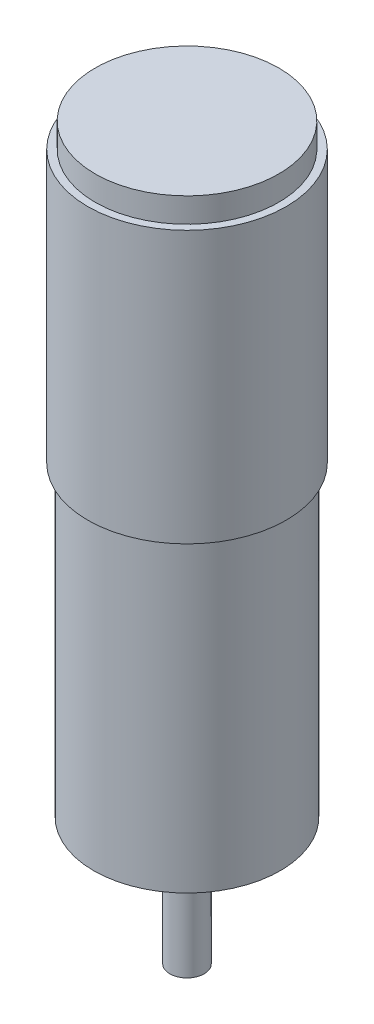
SolidWorks part; units mm, degrees
ref_plane "Front" through (0, 0, 0) normal (0, 0, 1) x (1, 0, 0)
ref_plane "Top" through (0, 0, 0) normal (0, 1, 0) x (1, 0, 0)
ref_plane "Right" through (0, 0, 0) normal (1, 0, 0) x (0, 0, -1)
sketch "Sketch1" plane through (0, 0, 0) normal (0, 1, 0) x (1, 0, 0)
  circle A0 centre (0, 0) radius 8.001
  dimension "D1" = 16.002
extrude "Base-Extrude" add sketch "Sketch1" along normal blind 26.289
sketch "Sketch2" plane through (0, 26.289, 0) normal (0, 1, 0) x (-1, 0, 0)
  circle A0 centre (0, 0) radius 8.509
  dimension "D1" = 17.018
extrude "Boss-Extrude1" add sketch "Sketch2" along normal blind 25.4
sketch "Sketch3" plane through (0, 51.689, 0) normal (0, 1, 0) x (-1, 0, 0)
  circle A0 centre (0, 0) radius 7.874
  circle A1 centre (0, 0) radius 8.509 construction
  circle A2 centre (0, 0) radius 8.509
  dimension "D1" = 15.748
extrude "Cut-Extrude1" cut sketch "Sketch3" against normal blind 2.1082
sketch "Sketch5" plane through (0, 0, 0) normal (0, -1, 0) x (1, 0, 0)
  circle A0 centre (0, 0) radius 2.9655
  dimension "D1" = 5.9309
extrude "Boss-Extrude3" add sketch "Sketch5" along normal blind 0.762
sketch "Sketch6" plane through (0, -0.762, 0) normal (0, -1, 0) x (1, 0, 0)
  circle A0 centre (0, 0) radius 2.4765
  dimension "D1" = 4.953
extrude "Boss-Extrude4" add sketch "Sketch6" along normal blind 1.27
sketch "Sketch7" plane through (0, -2.032, 0) normal (0, -1, 0) x (1, 0, 0)
  circle A0 centre (0, 0) radius 1.4732
  dimension "D1" = 2.9464
extrude "Boss-Extrude5" add sketch "Sketch7" along normal blind 8.89
sketch "Sketch8" plane through (0, 0, 0) normal (0, -1, 0) x (1, 0, 0)
  line L0 (0, 8.2043) -> (0, -8.1545) construction
  circle A0 centre (0, 5.3975) radius 0.9652
  circle A1 centre (0, -5.3975) radius 0.9652
  dimension "D1" = 10.795
  dimension "D2" = 5.3975
  dimension "D3" = 1.9304
  dimension "D4" = 1.9304
extrude "Cut-Extrude2" cut sketch "Sketch8" against normal blind 2.032
